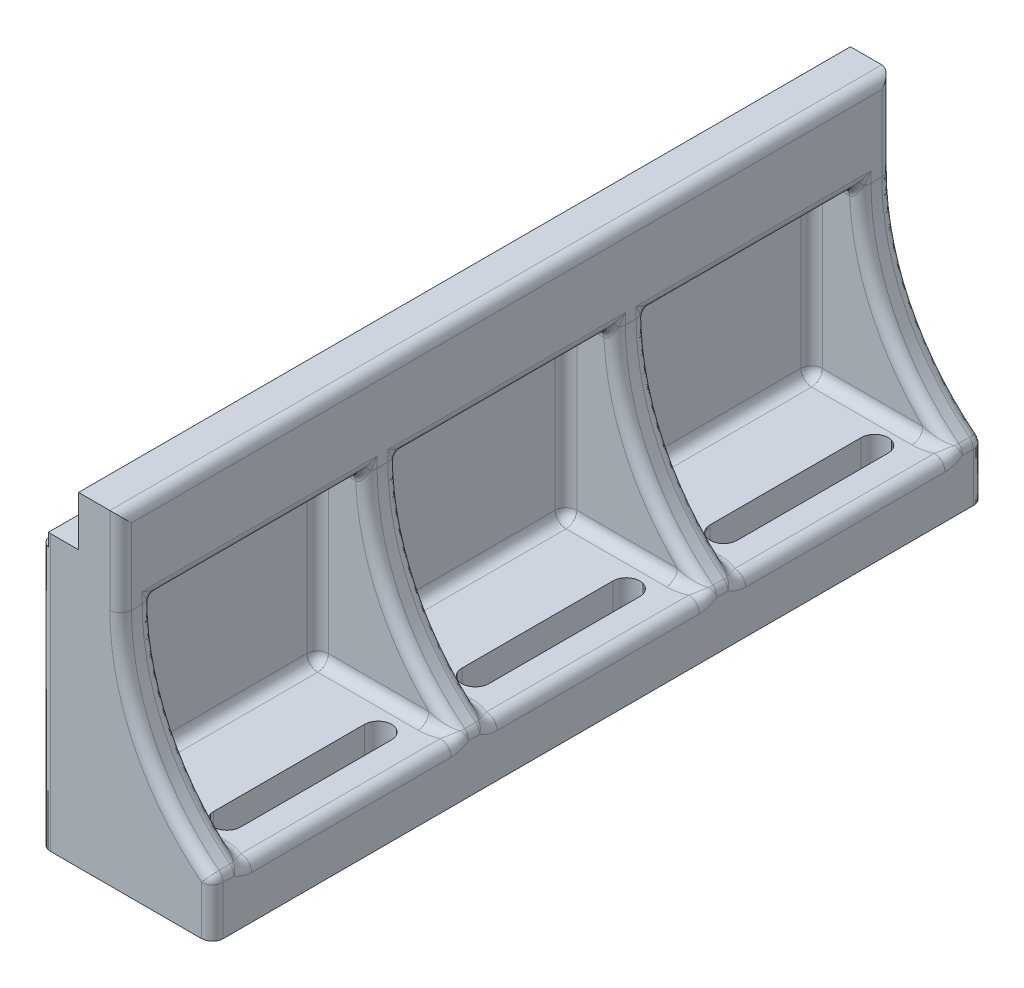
SolidWorks part; units mm, degrees
ref_plane "Plan de face" through (0, 0, 0) normal (0, 0, 1) x (1, 0, 0)
ref_plane "Plan de dessus" through (0, 0, 0) normal (0, 1, 0) x (1, 0, 0)
ref_plane "Plan de droite" through (0, 0, 0) normal (1, 0, 0) x (0, 0, -1)
sketch "Esquisse1" plane through (0, 0, 0) normal (0, 0, 1) x (1, 0, 0)
  line L0 (0, 0) -> (160, 0)
  line L1 (160, 0) -> (160, 50)
  line L2 (160, 50) -> (30, 50)
  line L3 (30, 50) -> (30, 221)
  line L4 (0, 0) -> (0, 243)
  line L5 (0, 243) -> (8, 243)
  line L6 (8, 243) -> (8, 255)
  line L7 (8, 255) -> (36, 255)
  line L8 (36, 255) -> (36, 301)
  line L9 (36, 301) -> (75, 301)
  line L10 (75, 301) -> (75, 221)
  line L11 (75, 221) -> (30, 221)
  dimension "D1" = 50
  dimension "D2" = 80
  dimension "D3" = 255
  dimension "D4" = 12
  dimension "D5" = 46
  dimension "D6" = 8
  dimension "D7" = 28
  dimension "D8" = 30
  dimension "D9" = 160
  dimension "D10" = 75
extrude "Boss.-Extru.1" add sketch "Esquisse1" along normal mid plane 715
sketch "Esquisse2" plane through (0, 0, 357.5) normal (0, 0, 1) x (1, 0, 0)
  line L0 (30, 221) -> (75, 221) construction
  line L1 (30, 50) -> (30, 221) construction
  line L2 (160, 50) -> (30, 50) construction
  line L3 (30, 221) -> (75, 221)
  line L4 (30, 50) -> (30, 221)
  line L5 (160, 50) -> (30, 50)
  line L6 (75, 221) -> (75, 301) construction
  arc A0 (75, 221) -> (160, 50) centre (289.5059, 221) ccw
extrude "Boss.-Extru.2" add sketch "Esquisse2" against normal blind 30
pattern_linear "Répétition linéaire1" count 2 spacing 227.5 along (0, 0, -1) of "Boss.-Extru.2"
mirror "Symétrie1" about plane through (0, 0, 0) normal (0, 0, 1) of "Répétition linéaire1", "Boss.-Extru.2"
fillet "Congé1" radius 10 28 edges at (97.4219, 125.5196, -357.5) (75, 221, -228.75) (75, 221, 0) (75, 221, 228.75) (75, 261, 357.5) (75, 301, 0) (75, 261, -357.5) (30, 135.5, -327.5) (30, 50, -228.75) (30, 135.5, -130) (30, 221, -228.75) (30, 50, 0) (30, 135.5, 100) (30, 221, 0) (30, 135.5, -100) (30, 135.5, 327.5) (30, 221, 228.75) (30, 135.5, 130) (30, 50, 228.75) (0, 121.5, -357.5) (0, 121.5, 357.5) (97.4219, 125.5196, -130) (97.4219, 125.5196, -100) (97.4219, 125.5196, 100) (97.4219, 125.5196, 130) (97.4219, 125.5196, 327.5) (97.4219, 125.5196, 357.5) (97.4219, 125.5196, -327.5)
fillet "Congé2" radius 10 30 edges at (32.9289, 218.0711, 132.9289) (32.9289, 218.0711, -97.0711) (32.9289, 218.0711, -324.5711) (52.5, 221, -130) (52.5, 221, 100) (32.9289, 52.9289, -324.5711) (32.9289, 52.9289, -132.9289) (32.9289, 52.9289, -97.0711) (92.0173, 50, -100) (158.2438, 50, -105.5097) (156.1414, 50, -126.442) (32.9289, 52.9289, 97.0711) (32.9289, 52.9289, 132.9289) (92.0173, 50, 130) (158.2438, 50, 124.4903) (156.1414, 50, 103.558) (32.9289, 52.9289, 324.5711) (156.1414, 50, 331.058) (52.5, 221, 130) (52.5, 221, -100) (52.5, 221, -327.5) (32.9289, 218.0711, -132.9289) (32.9289, 218.0711, 97.0711) (92.0173, 50, -327.5) (92.0173, 50, -130) (92.0173, 50, 100) (92.0173, 50, 327.5) (32.9289, 218.0711, 324.5711) (52.5, 221, 327.5) (158.2438, 50, -333.0097)
fillet "Congé3" radius 10 5 edges at (160, 18.8061, 357.5) (160, 45.8459, 354.947) (160, 50.5702, 336.3337) (160, 50, 228.75) (160, 50, 346.9771)
sketch "Esquisse3" plane through (0, 50, 0) normal (0, 1, 0) x (1, 0, 0)
  line L0 (116, 70) -> (116, -70) construction
  line L1 (128.5, 70) -> (128.5, -70)
  line L2 (103.5, 70) -> (103.5, -70)
  line L3 (36, -357.5) -> (36, 357.5) construction
  arc A0 (128.5, 70) -> (103.5, 70) centre (116, 70) ccw
  arc A1 (103.5, -70) -> (128.5, -70) centre (116, -70) ccw
  point P2 (116, 0)
  dimension "D3" = 140
  dimension "D1" = 25
  dimension "D2" = 80
extrude "Enlèv. mat.-Extru.1" cut sketch "Esquisse3" against normal up to next
pattern_linear "Répétition linéaire2" count 2 spacing 230 along (0, 0, -1) count 2 spacing 230 along (0, 0, 1) of "Enlèv. mat.-Extru.1"
